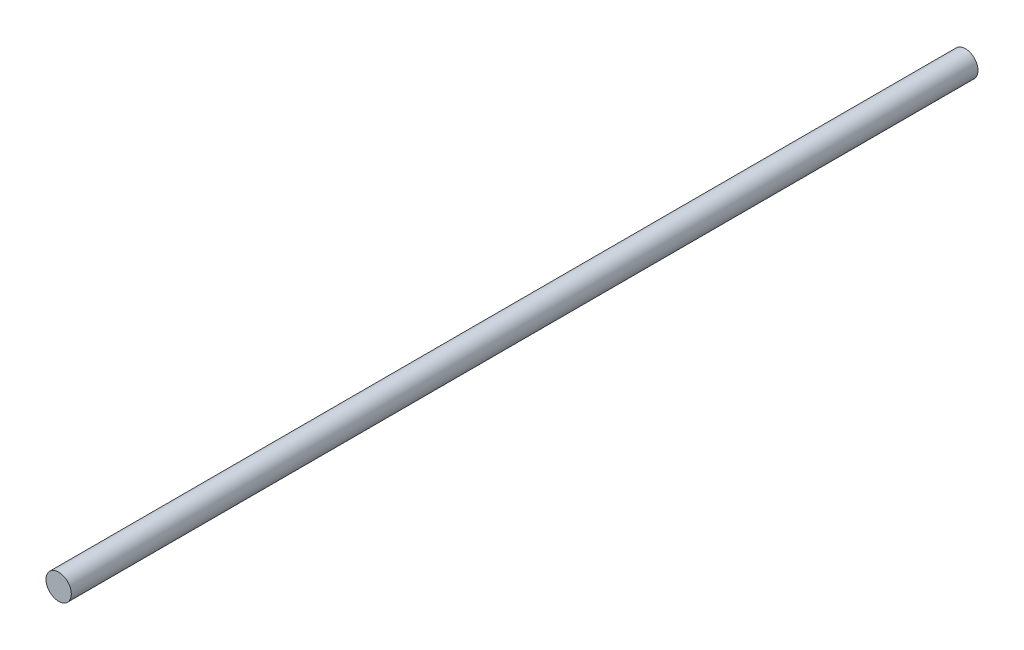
SolidWorks part; units mm, degrees
ref_plane "Front Plane" through (0, 0, 0) normal (0, 0, 1) x (1, 0, 0)
ref_plane "Top Plane" through (0, 0, 0) normal (0, 1, 0) x (1, 0, 0)
ref_plane "Right Plane" through (0, 0, 0) normal (1, 0, 0) x (0, 0, -1)
sketch "Sketch2" plane through (0, 0, 0) normal (0, 0, 1) x (1, 0, 0)
  circle A0 centre (0, 0) radius 0.9779
  dimension "D1" = 1.9558
extrude "Boss-Extrude1" add sketch "Sketch2" along normal blind 70.0024
